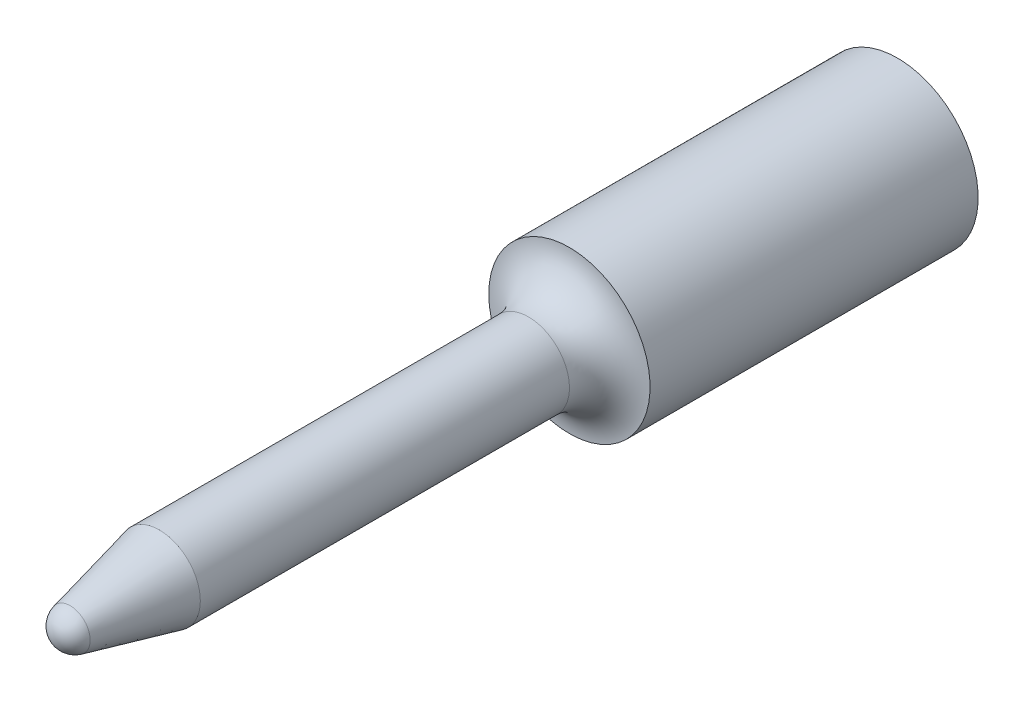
SolidWorks part; units mm, degrees
ref_plane "Plan de face" through (0, 0, 0) normal (0, 0, 1) x (1, 0, 0)
ref_plane "Plan de dessus" through (0, 0, 0) normal (0, 1, 0) x (1, 0, 0)
ref_plane "Plan de droite" through (0, 0, 0) normal (1, 0, 0) x (0, 0, -1)
sketch "Esquisse1" plane through (0, 0, 0) normal (0, 0, 1) x (1, 0, 0)
  circle A0 centre (0, 0) radius 1.5
  dimension "D1" = 3
extrude "Boss.-Extru.1" add sketch "Esquisse1" along normal blind 15
sketch "Esquisse2" plane through (0, 0, 0) normal (0, 1, 0) x (1, 0, 0)
  line L0 (0, -13.5855) -> (0, -18.0862) construction
  line L1 (0, -15) -> (1.5, -15)
  line L2 (-1.5, -15) -> (1.5, -15) construction
  line L3 (1.5, -15) -> (0.7299, -18.2587)
  line L4 (0, -18.0862) -> (0, -19.4004) construction
  line L5 (0, -15) -> (0, -18.8362)
  arc A0 (0, -18.8362) -> (0.7299, -18.2587) centre (0, -18.0862) ccw
  dimension "D1" = 1.5
revolve "Révolution1" add sketch "Esquisse2" angle 360 about L5
sketch "Esquisse3" plane through (0, 0, 0) normal (0, 0, -1) x (-1, 0, 0)
  circle A0 centre (0, 0) radius 2.95
  dimension "D1" = 5.9
extrude "Boss.-Extru.2" add sketch "Esquisse3" along normal blind 12
fillet "Congé1" radius 1.5 1 edges at (-1.5, 0, 0)
